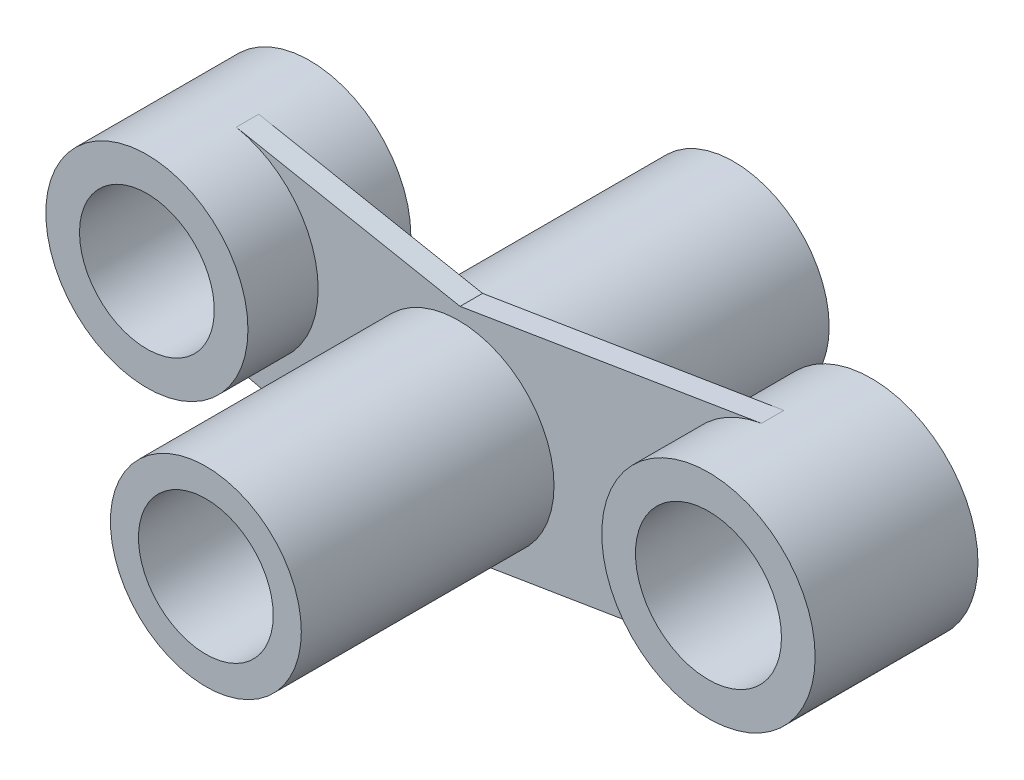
SolidWorks part; units mm, degrees
ref_plane "Plan de face" through (0, 0, 0) normal (0, 0, 1) x (1, 0, 0)
ref_plane "Plan de dessus" through (0, 0, 0) normal (0, 1, 0) x (1, 0, 0)
ref_plane "Plan de droite" through (0, 0, 0) normal (1, 0, 0) x (0, 0, -1)
sketch "Esquisse1" plane through (0, 0, 0) normal (0, 0, 1) x (1, 0, 0)
  circle A0 centre (0, 0) radius 12
  circle A1 centre (0, 0) radius 18
  dimension "D2" = 24
  dimension "D1" = 6
extrude "Extrusion1" add sketch "Esquisse1" along normal mid plane 29
sketch "Esquisse2" plane through (0, 0, 0) normal (0, 0, 1) x (1, 0, 0)
  line L0 (0, 0) -> (202.016, 0) construction
  circle A0 centre (100, 0) radius 13
  circle A1 centre (100, 0) radius 19
  dimension "D2" = 26
  dimension "D3" = 100
  dimension "D1" = 6
extrude "Extrusion2" add sketch "Esquisse2" along normal mid plane 29
sketch "Esquisse3" plane through (0, 0, 0) normal (0, 0, 1) x (1, 0, 0)
  circle A0 centre (43, -9.3274) radius 12
  circle A1 centre (43, -9.3274) radius 17
  circle A3 centre (100, 0) radius 19 construction
  dimension "D2" = 24
  dimension "D4" = 57
  dimension "D3" = 44
  dimension "D1" = 5
extrude "Extrusion3" add sketch "Esquisse3" along normal mid plane 94
sketch "Esquisse4" plane through (0, 0, 0) normal (0, 0, 1) x (1, 0, 0)
  line L0 (38.5513, -27.7992) -> (-4.2146, -17.4996)
  line L1 (46.0683, -28.078) -> (103.0683, -18.7506)
  line L2 (43.2767, 9.9706) -> (96.9317, 18.7506)
  line L3 (43.2767, 9.9706) -> (3.415, 17.6731)
  circle A2 centre (0, 0) radius 18
  arc A3 (3.415, 17.6731) -> (-4.2146, -17.4996) centre (0, 0) ccw
  circle A5 centre (43, -9.3274) radius 19
  arc A6 (38.5513, -27.7992) -> (46.0683, -28.078) centre (43, -9.3274) ccw
  circle A7 centre (0, 0) radius 12 construction
  circle A8 centre (100, 0) radius 19
  arc A9 (103.0683, -18.7506) -> (96.9317, 18.7506) centre (100, 0) ccw
  circle A10 centre (0, 0) radius 12
  circle A11 centre (43, -9.3274) radius 12 construction
  circle A12 centre (43, -9.3274) radius 12
  circle A13 centre (100, 0) radius 13 construction
  circle A14 centre (100, 0) radius 13
  dimension "D1" = 0
  dimension "D2" = 2
  dimension "D3" = 0
extrude "Extrusion4" add sketch "Esquisse4" along normal mid plane 4
